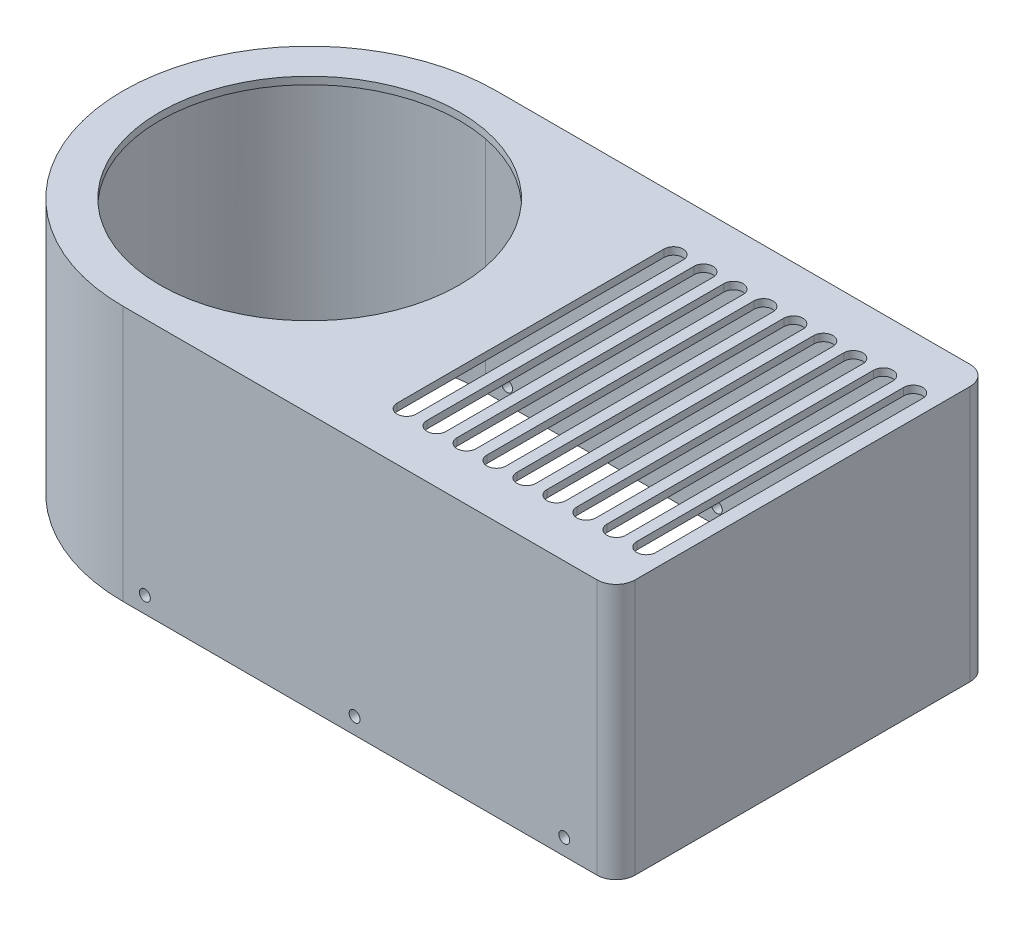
SolidWorks part; units mm, degrees
ref_plane "Front Plane" through (0, 0, 0) normal (0, 0, 1) x (1, 0, 0)
ref_plane "Top Plane" through (0, 0, 0) normal (0, 1, 0) x (1, 0, 0)
ref_plane "Right Plane" through (0, 0, 0) normal (1, 0, 0) x (0, 0, -1)
sketch "Sketch1" plane through (0, 0, 0) normal (0, 1, 0) x (1, 0, 0)
  line L0 (0, 64.5) -> (177, 64.5)
  line L1 (0, -64.5) -> (177, -64.5)
  line L2 (177, 64.5) -> (177, -64.5)
  line L3 (0, -68.5) -> (181, -68.5)
  line L4 (181, -68.5) -> (181, 68.5)
  line L5 (181, 68.5) -> (0, 68.5)
  circle A1 centre (0, 0) radius 25 construction
  arc A2 (0, 64.5) -> (0, -64.5) centre (0, 0) ccw
  arc A4 (0, -68.5) -> (0, 68.5) centre (0, 0) cw
  point P6 (181, 0)
  point P11 (177, 0)
  dimension "D1" = 4
  dimension "D2" = 50
  dimension "D3" = 129
  dimension "D4" = 177
  dimension "D5" = 4
  dimension "D6" = 4
extrude "Boss-Extrude1" add sketch "Sketch1" along normal blind 93.9
sketch "Sketch2" plane through (0, 93.9, 0) normal (0, 1, 0) x (1, 0, 0)
  line L0 (0, -64.5) -> (177, -64.5)
  line L1 (177, -64.5) -> (177, 64.5)
  line L2 (177, 64.5) -> (0, 64.5)
  arc A0 (0, 64.5) -> (0, -64.5) centre (0, 0) ccw
extrude "Boss-Extrude2" add sketch "Sketch2" against normal blind 2.7
fillet "Fillet1" radius 7 2 edges at (181, 46.95, -68.5) (181, 46.95, 68.5)
fillet "Fillet2" radius 7 2 edges at (177, 45.6, 64.5) (177, 45.6, -64.5)
sketch "Sketch3" plane through (0, 93.9, 0) normal (0, 1, 0) x (1, 0, 0)
  line L0 (181, 0) -> (172.6, 0) construction
  line L1 (181, -61.5) -> (181, 61.5) construction
  line L2 (172.6, 49) -> (172.6, -49) construction
  line L3 (176.1, 49) -> (176.1, -49)
  line L4 (169.1, 49) -> (169.1, -49)
  line L5 (150.6, 49) -> (150.6, -49) construction
  line L6 (154.1, 49) -> (154.1, -49)
  line L7 (147.1, 49) -> (147.1, -49)
  line L8 (161.6, 49) -> (161.6, -49) construction
  line L9 (165.1, 49) -> (165.1, -49)
  line L10 (158.1, 49) -> (158.1, -49)
  line L11 (139.6, 49) -> (139.6, -49) construction
  line L12 (143.1, 49) -> (143.1, -49)
  line L13 (136.1, 49) -> (136.1, -49)
  line L14 (161.6, 0) -> (172.6, 0) construction
  line L15 (150.6, 0) -> (161.6, 0) construction
  line L16 (139.6, 0) -> (150.6, 0) construction
  line L17 (128.6, 49) -> (128.6, -49) construction
  line L18 (132.1, 49) -> (132.1, -49)
  line L19 (125.1, 49) -> (125.1, -49)
  line L20 (117.6, 49) -> (117.6, -49) construction
  line L21 (121.1, 49) -> (121.1, -49)
  line L22 (114.1, 49) -> (114.1, -49)
  line L23 (106.6, 49) -> (106.6, -49) construction
  line L24 (110.1, 49) -> (110.1, -49)
  line L25 (103.1, 49) -> (103.1, -49)
  line L26 (95.6, -49) -> (95.6, 49) construction
  line L29 (139.6, 0) -> (128.6, 0) construction
  line L30 (128.6, 0) -> (117.6, 0) construction
  line L31 (117.6, 0) -> (106.6, 0) construction
  line L32 (106.6, 0) -> (95.6, 0) construction
  line L33 (92.1, -49) -> (92.1, 49)
  line L36 (99.1, -49) -> (99.1, 49)
  line L37 (84.6, -49) -> (84.6, 49) construction
  line L38 (81.1, -49) -> (81.1, 49)
  line L39 (88.1, -49) -> (88.1, 49)
  circle A0 centre (0, 0) radius 55
  arc A1 (176.1, 49) -> (169.1, 49) centre (172.6, 49) ccw
  arc A2 (169.1, -49) -> (176.1, -49) centre (172.6, -49) ccw
  arc A3 (154.1, 49) -> (147.1, 49) centre (150.6, 49) ccw
  arc A4 (147.1, -49) -> (154.1, -49) centre (150.6, -49) ccw
  arc A5 (165.1, 49) -> (158.1, 49) centre (161.6, 49) ccw
  arc A6 (158.1, -49) -> (165.1, -49) centre (161.6, -49) ccw
  arc A7 (143.1, 49) -> (136.1, 49) centre (139.6, 49) ccw
  arc A8 (136.1, -49) -> (143.1, -49) centre (139.6, -49) ccw
  arc A9 (132.1, 49) -> (125.1, 49) centre (128.6, 49) ccw
  arc A10 (125.1, -49) -> (132.1, -49) centre (128.6, -49) ccw
  arc A11 (121.1, 49) -> (114.1, 49) centre (117.6, 49) ccw
  arc A12 (114.1, -49) -> (121.1, -49) centre (117.6, -49) ccw
  arc A13 (110.1, 49) -> (103.1, 49) centre (106.6, 49) ccw
  arc A14 (103.1, -49) -> (110.1, -49) centre (106.6, -49) ccw
  arc A19 (92.1, -49) -> (99.1, -49) centre (95.6, -49) ccw
  arc A20 (99.1, 49) -> (92.1, 49) centre (95.6, 49) ccw
  arc A21 (81.1, -49) -> (88.1, -49) centre (84.6, -49) ccw
  arc A22 (88.1, 49) -> (81.1, 49) centre (84.6, 49) ccw
  point P9 (172.6, 0)
  point P17 (150.6, 0)
  point P24 (161.6, 0)
  point P31 (139.6, 0)
  point P40 (128.6, 0)
  point P47 (117.6, 0)
  point P54 (106.6, 0)
  point P61 (95.6, 0)
  point P70 (0, 0)
  point P73 (84.6, 0)
  point P78 (0, 0)
  dimension "D1" = 110
  dimension "D3" = 3.5
  dimension "D6" = 11
  dimension "D2" = 8.4
  dimension "D4" = 98
  dimension "D5" = 11
extrude "Cut-Extrude1" cut sketch "Sketch3" against normal through all
sketch "Sketch5" plane through (0, 91.2, 0) normal (0, -1, 0) x (1, 0, 0)
  line L0 (0, 64.5) -> (23.0651, 64.5)
  line L1 (0, -64.5) -> (23.0651, -64.5)
  arc A3 (0, -64.5) -> (0, 64.5) centre (0, 0) ccw
  arc A5 (23.0651, -64.5) -> (23.0651, 64.5) centre (0, 0) ccw
extrude "Boss-Extrude3" add sketch "Sketch5" along normal blind 7
chamfer "Chamfer1" distance 0.4 angle 45 2 edges at (68.5, 84.2, 0) (64.5, 84.2, 0)
sketch "Sketch9" plane through (0, 0, 64.5) normal (0, 0, -1) x (-1, 0, 0)
  line L0 (0, 3) -> (-3, 3) construction
  line L1 (-3, 3) -> (-3, 6) construction
  line L2 (-13, 3) -> (-13, 6) construction
  line L3 (-13, 3) -> (-3, 3) construction
  line L4 (-157, 3) -> (-90, 3) construction
  line L5 (-157, 3) -> (-157, 6) construction
  line L6 (-167, 3) -> (-167, 6) construction
  line L7 (-167, 3) -> (-157, 3) construction
  line L8 (-80, 3) -> (-80, 6) construction
  line L9 (-90, 3) -> (-90, 6) construction
  line L10 (-90, 3) -> (-80, 3) construction
  line L11 (-170, 3) -> (-167, 3) construction
  line L12 (-157, 3) -> (-90, 3) construction
  line L13 (-80, 3) -> (-13, 3) construction
  arc A0 (-13, 6) -> (-3, 6) centre (-8, 6) cw construction
  circle A1 centre (-8, 6) radius 2
  arc A2 (-167, 6) -> (-157, 6) centre (-162, 6) cw construction
  circle A3 centre (-162, 6) radius 2
  arc A4 (-90, 6) -> (-80, 6) centre (-85, 6) cw construction
  circle A5 centre (-85, 6) radius 2
  dimension "D3" = 5
  dimension "D4" = 4
  dimension "D1" = 3
  dimension "D2" = 3
  dimension "D5" = 3
  dimension "D6" = 3
extrude "Cut-Extrude3" cut sketch "Sketch9" against normal up to surface and the other way up to surface
